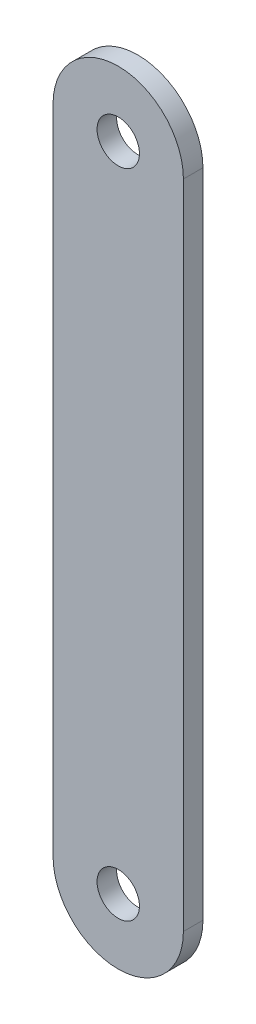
SolidWorks part; units mm, degrees
ref_plane "Front Plane" through (0, 0, 0) normal (0, 0, 1) x (1, 0, 0)
ref_plane "Top Plane" through (0, 0, 0) normal (0, 1, 0) x (1, 0, 0)
ref_plane "Right Plane" through (0, 0, 0) normal (1, 0, 0) x (0, 0, -1)
sketch "Sketch1" plane through (0, 0, 0) normal (0, 0, 1) x (1, 0, 0)
  line L0 (0, 0) -> (0, 100) construction
  line L1 (10, 0) -> (10, 100)
  line L2 (-10, 0) -> (-10, 100)
  circle A0 centre (0, 100) radius 3.25
  circle A1 centre (0, 0) radius 3.25
  arc A2 (10, 0) -> (-10, 0) centre (0, 0) cw
  arc A3 (10, 100) -> (-10, 100) centre (0, 100) ccw
  dimension "D2" = 6.5
  dimension "D1" = 100
  dimension "D3" = 10
  dimension "D4" = 10
extrude "Extrude1" add sketch "Sketch1" along normal blind 3
